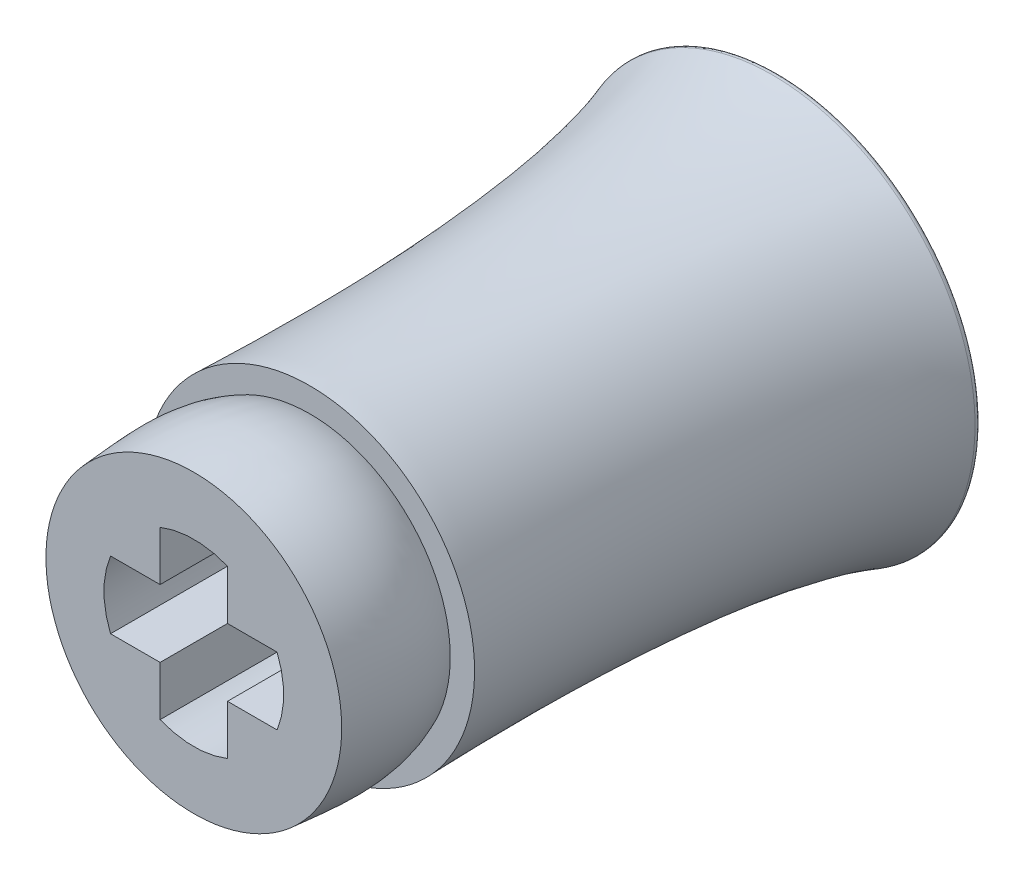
SolidWorks part; units mm, degrees
ref_plane "Front Plane" through (0, 0, 0) normal (0, 0, 1) x (1, 0, 0)
ref_plane "Top Plane" through (0, 0, 0) normal (0, 1, 0) x (1, 0, 0)
ref_plane "Right Plane" through (0, 0, 0) normal (1, 0, 0) x (0, 0, -1)
sketch "Sketch1" plane through (0, 0, 0) normal (0, 0, 1) x (1, 0, 0)
  circle A0 centre (0, 0) radius 4.4
  dimension "D1" = 8.8
ref_plane "Plane1" through (0, 0, -12.5) normal (0, 0, 1) x (1, 0, 0)
sketch "Sketch2" plane through (0, 0, -12.5) normal (0, 0, 1) x (1, 0, 0)
  circle A0 centre (0, 0) radius 5.45
  dimension "D1" = 10.9
loft "Loft1" add profiles "Sketch1", "Sketch2"
sketch "Sketch3" plane through (0, 0, -12.5) normal (0, 0, -1) x (-1, 0, 0)
  circle A2 centre (0, 0) radius 3.95
  circle A3 centre (0, 0) radius 3.95
  dimension "D1" = 1.5
sketch "Sketch4" plane through (0, 0, 0) normal (0, 0, 1) x (1, 0, 0)
  circle A3 centre (0, 0) radius 2.35
  dimension "D1" = 4.7
loft "Cut-Loft1" cut profiles "Sketch4", "Sketch3"
sketch "Sketch5" plane through (0, 0, 0) normal (0, 0, 1) x (1, 0, 0)
  circle A0 centre (0, 0) radius 3.75
  dimension "D1" = 7.5
ref_plane "Plane2" through (0, 0, 3.1) normal (0, 0, 1) x (1, 0, 0)
sketch "Sketch6" plane through (0, 0, 3.1) normal (0, 0, 1) x (1, 0, 0)
  circle A0 centre (0, 0) radius 3.95
  dimension "D1" = 7.9
loft "Loft2" add profiles "Sketch5", "Sketch6"
ref_plane "Plane3" through (0, 0, -4.77) normal (0, 0, 1) x (1, 0, 0)
fillet "Fillet3" radius 0.1 2 edges at (1.6587, 3.5855, -12.5) (5.45, 0, -12.5)
sketch "Sketch7" plane through (0, 0, 3.1) normal (0, 0, 1) x (1, 0, 0)
  line L0 (-3.6363, 0) -> (2.4, 0) construction
  line L1 (0, 3.124) -> (0, -3.2009) construction
  line L2 (-2.2249, 0.9) -> (-0.9, 0.9)
  line L3 (0.9, 0.9) -> (2.2249, 0.9)
  line L4 (2.2249, -0.9) -> (0.9, -0.9)
  line L5 (-0.9, 2.2249) -> (-0.9, 0.9)
  line L6 (0.9, 0.9) -> (0.9, 2.2249)
  line L7 (0.9, -2.2249) -> (0.9, -0.9)
  line L8 (-0.9, -0.9) -> (-2.2249, -0.9)
  line L9 (-0.9, -0.9) -> (-0.9, -2.2249)
  arc A0 (0.9, 2.2249) -> (-0.9, 2.2249) centre (0, 0) ccw
  arc A1 (-2.2249, 0.9) -> (-2.2249, -0.9) centre (0, 0) ccw
  arc A2 (-0.9, -2.2249) -> (0.9, -2.2249) centre (0, 0) ccw
  arc A3 (2.2249, -0.9) -> (2.2249, 0.9) centre (0, 0) ccw
  dimension "D1" = 4.8
  dimension "D3" = 0.9
  dimension "D5" = 0.9
extrude "Cut-Extrude1" cut sketch "Sketch7" against normal through all
